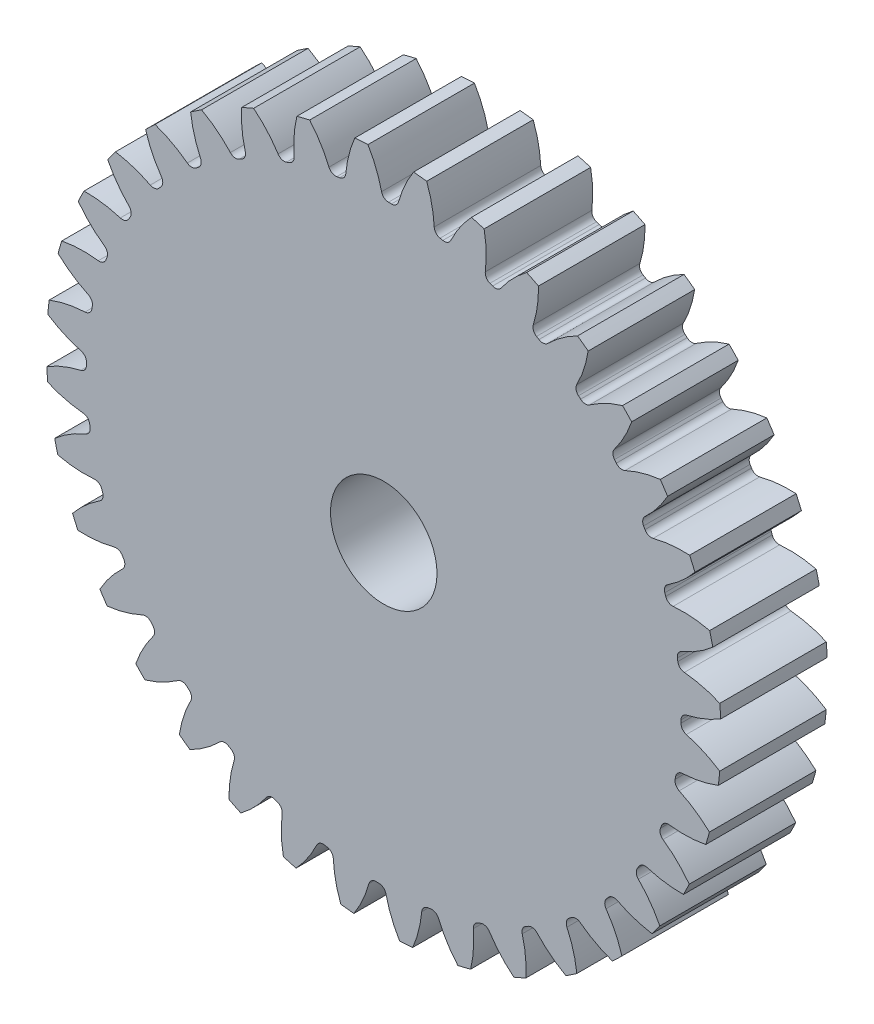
SolidWorks part; units mm, degrees
ref_plane "Front" through (0, 0, 0) normal (0, 0, 1) x (1, 0, 0)
ref_plane "Top" through (0, 0, 0) normal (0, 1, 0) x (1, 0, 0)
ref_plane "Right" through (0, 0, 0) normal (1, 0, 0) x (0, 0, -1)
sketch "Sketch3" plane through (0, 0, 0) normal (0, 0, 1) x (1, 0, 0)
  circle A0 centre (0, 0) radius 321.7333
  dimension "od" = 643.4667
extrude "gearBody" add sketch "Sketch3" along normal blind 101.6
sketch "Sketch2" plane through (0, 0, 0) normal (0, 0, 1) x (1, 0, 0)
  line L0 (0, 0) -> (264.616, 109.6075) construction
  line L1 (320.8183, -28.6747) -> (0, 0) construction
  line L2 (0, 0) -> (36.3143, 0) construction
  line L3 (304.7216, 6.9108) -> (304.1705, -19.5788) construction
  line L5 (304.4461, -6.334) -> (0, 0) construction
  line L7 (0, 0) -> (286.4183, 0) construction
  arc A0 (286.4142, 1.5339) -> (286.1026, -13.445) centre (0, 0) ccw construction
  arc A1 (321.3791, 15.0928) -> (320.4733, -28.4465) centre (0, 0) ccw construction
  arc A2 (304.7216, 6.9108) -> (304.1705, -19.5788) centre (0, 0) ccw construction
  arc A3 (283.5402, -7.2677) -> (283.5971, -4.5315) centre (0, 0) ccw
  arc A4 (320.8183, -28.6747) -> (288.6294, -14.0969) centre (259.8283, -120.5186) ccw
  arc A5 (320.8183, -28.6747) -> (321.7333, 15.3065) centre (0, 0) ccw
  arc A6 (321.7333, 15.3065) -> (288.966, 2.08) centre (264.616, 109.6075) cw
  arc A7 (283.5971, -4.5315) -> (288.966, 2.08) centre (290.4881, -4.6416) cw
  arc A8 (288.6294, -14.0969) -> (283.5402, -7.2677) centre (290.4298, -7.4443) cw
  point P6 (321.7333, 15.3065)
  point P22 (320.8183, -28.6747)
  dimension "baseDia" = 572.8366
  dimension "od" = 643.4667
  dimension "pd" = 609.6
  dimension "rd" = 567.2667
  dimension "rFillet" = 6.8919
  dimension "pointX" = 321.7333
  dimension "pointY" = 15.3065
  dimension "CTT" = 26.4896
  dimension "flankCenterAngle" = 22.5
extrude "toothCut" cut sketch "Sketch2" along normal through all
pattern_circular "CirPattern1" count 36 over 360 about axis through (0, 0, 0) along (0, 0, 1) of "toothCut"
sketch "hub1Dia" plane through (0, 0, 0) normal (0, 0, -1) x (-1, 0, 0)
  circle A0 centre (0, 0) radius 12.7
  dimension "hub1Dia" = 25.4
sketch "hub2Dia" plane through (0, 0, 101.6) normal (0, 0, 1) x (1, 0, 0)
  circle A0 centre (0, 0) radius 12.7
  dimension "hub2dia" = 25.4
sketch "boreDia" plane through (0, 0, 0) normal (0, 0, 1) x (1, 0, 0)
  circle A0 centre (0, 0) radius 50.8
  dimension "boreDia" = 101.6
extrude "bore" cut sketch "boreDia" against normal mid plane 25400
